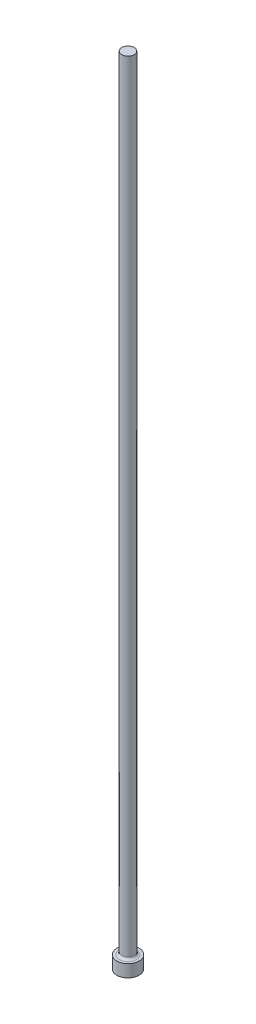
SolidWorks part; units mm, degrees
ref_plane "Front Plane" through (0, 0, 0) normal (0, 0, 1) x (1, 0, 0)
ref_plane "Top Plane" through (0, 0, 0) normal (0, 1, 0) x (1, 0, 0)
ref_plane "Right Plane" through (0, 0, 0) normal (1, 0, 0) x (0, 0, -1)
sketch "Sketch1" plane through (0, 0, 0) normal (0, 0, 1) x (1, 0, 0)
  line L0 (0, 0) -> (3.556, 0)
  line L1 (55, 0) -> (-55, 0) construction
  line L2 (3.556, 0) -> (3.556, 3.9624)
  line L3 (3.556, 3.9624) -> (2.7457, 3.9624)
  line L4 (1.9837, 4.7244) -> (1.9837, 254)
  line L5 (1.9837, 254) -> (0, 254)
  line L6 (0, 254) -> (0, 0)
  arc A0 (2.7457, 3.9624) -> (1.9837, 4.7244) centre (2.7457, 4.7244) cw
  dimension "D5" = 0.762
  dimension "D1" = 1.9837
  dimension "D2" = 3.556
  dimension "D3" = 3.9624
  dimension "D4" = 254
revolve "Revolve1" add sketch "Sketch1" angle 360 about L6
